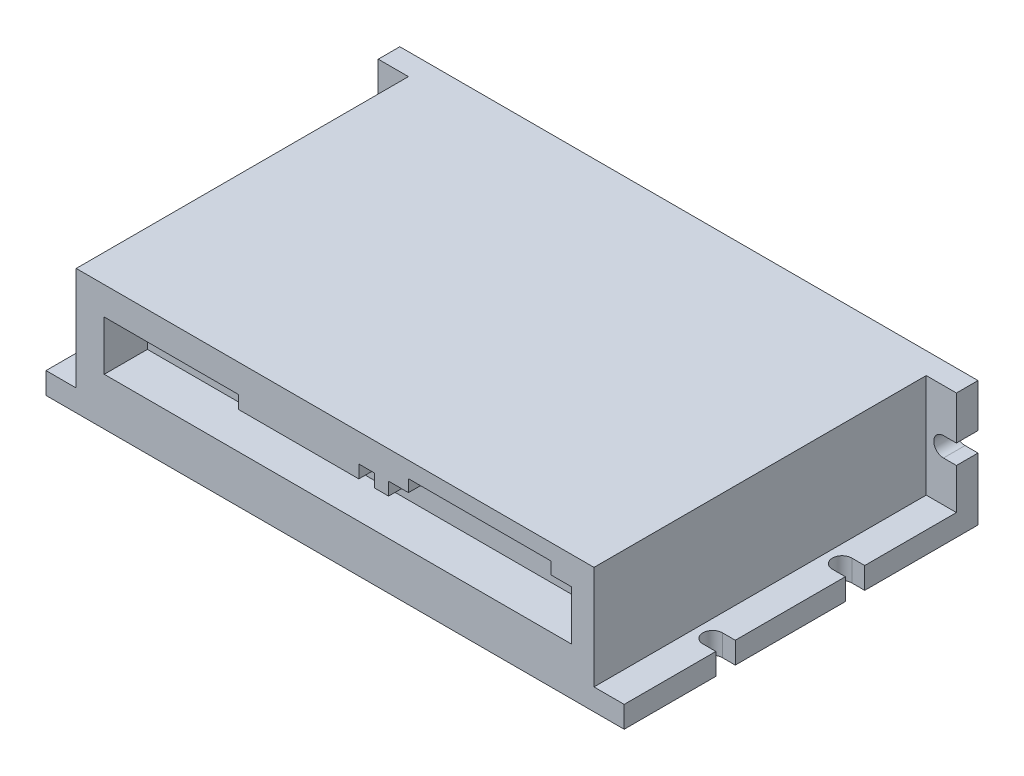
SolidWorks part; units mm, degrees
ref_plane "前视" through (0, 0, 0) normal (0, 0, 1) x (1, 0, 0)
ref_plane "上视" through (0, 0, 0) normal (0, 1, 0) x (1, 0, 0)
ref_plane "右视" through (0, 0, 0) normal (1, 0, 0) x (0, 0, -1)
sketch "草图1" plane through (0, 0, 0) normal (0, 1, 0) x (1, 0, 0)
  line L1 (0, 0) -> (134, 0)
  line L2 (0, 0) -> (0, 82)
  line L3 (0, 82) -> (134, 82)
  line L4 (134, 0) -> (134, 82)
extrude "凸台-拉伸1" add sketch "草图1" along normal blind 29
sketch "草图2" plane through (0, 0, 0) normal (0, 0, 1) x (1, 0, 0)
  line L1 (0, 29) -> (7, 29)
  line L2 (0, 29) -> (0, 5)
  line L3 (0, 5) -> (7, 5)
  line L4 (7, 29) -> (7, 5)
  line L5 (134, 29) -> (127, 29)
  line L6 (134, 29) -> (134, 5)
  line L7 (134, 5) -> (127, 5)
  line L8 (127, 29) -> (127, 5)
extrude "切除-拉伸1" cut sketch "草图2" against normal blind 77
ref_plane "基准面1" through (0, 0, -77) normal (0, 0, 1) x (1, 0, 0)
sketch "草图3" plane through (0, 0, -77) normal (0, 0, 1) x (1, 0, 0)
  line L0 (131, 18.95) -> (134, 18.95)
  line L2 (134, 5) -> (134, 29) construction
  line L3 (134, 18.95) -> (134, 14.45)
  line L4 (134, 14.45) -> (131, 14.45)
  line L5 (3, 18.95) -> (0, 18.95)
  line L7 (0, 29) -> (0, 5) construction
  line L8 (0, 18.95) -> (0, 14.45)
  line L9 (0, 14.45) -> (3, 14.45)
  arc A0 (131, 18.95) -> (131, 14.45) centre (131, 16.7) ccw
  arc A1 (3, 18.95) -> (3, 14.45) centre (3, 16.7) cw
extrude "切除-拉伸2" cut sketch "草图3" against normal blind 52
ref_plane "基准面2" through (0, 5, 0) normal (0, 1, 0) x (1, 0, 0)
sketch "草图4" plane through (0, 5, 0) normal (0, 1, 0) x (1, 0, 0)
  line L1 (0, 77) -> (0, 0) construction
  line L3 (3, 25.75) -> (0, 25.75)
  line L4 (3, 55.75) -> (0, 55.75)
  line L5 (0, 55.75) -> (0, 51.25)
  line L6 (134, 77) -> (134, 0) construction
  line L7 (0, 51.25) -> (3, 51.25)
  line L8 (0, 25.75) -> (0, 21.25)
  line L10 (131, 55.75) -> (134, 55.75)
  line L11 (134, 55.75) -> (134, 51.25)
  line L12 (134, 51.25) -> (131, 51.25)
  line L13 (131, 25.75) -> (134, 25.75)
  line L14 (134, 25.75) -> (134, 21.25)
  line L15 (134, 21.25) -> (131, 21.25)
  line L16 (0, 21.25) -> (3, 21.25)
  arc A0 (131, 55.75) -> (131, 51.25) centre (131, 53.5) ccw
  arc A1 (131, 25.75) -> (131, 21.25) centre (131, 23.5) ccw
  arc A2 (3, 55.75) -> (3, 51.25) centre (3, 53.5) cw
  arc A3 (3, 25.75) -> (3, 21.25) centre (3, 23.5) cw
extrude "切除-拉伸3" cut sketch "草图4" against normal blind 5
sketch "草图5" plane through (0, 0, 0) normal (0, 0, 1) x (1, 0, 0)
  line L0 (13.5, 11) -> (121.8, 11)
  line L2 (44.6, 22.5) -> (44.6, 19.5)
  line L3 (13.5, 11) -> (13.5, 22.5)
  line L4 (13.5, 22.5) -> (44.6, 22.5)
  line L5 (44.6, 19.5) -> (72.5, 19.5)
  line L6 (72.5, 19.5) -> (72.5, 22.5)
  line L7 (72.5, 22.5) -> (76.1, 22.5)
  line L8 (76.1, 22.5) -> (76.1, 19.5)
  line L9 (76.1, 19.5) -> (79.4, 19.5)
  line L10 (79.4, 19.5) -> (79.4, 22.5)
  line L11 (79.4, 22.5) -> (84, 22.5)
  line L12 (84, 22.5) -> (84, 25.3)
  line L13 (84, 25.3) -> (117, 25.3)
  line L14 (117, 25.3) -> (117, 22.5)
  line L15 (117, 22.5) -> (121.8, 22.5)
  line L16 (121.8, 22.5) -> (121.8, 11)
extrude "切除-拉伸4" cut sketch "草图5" against normal blind 10
ref_plane "基准面3" through (0, 0, -10) normal (0, 0, 1) x (1, 0, 0)
